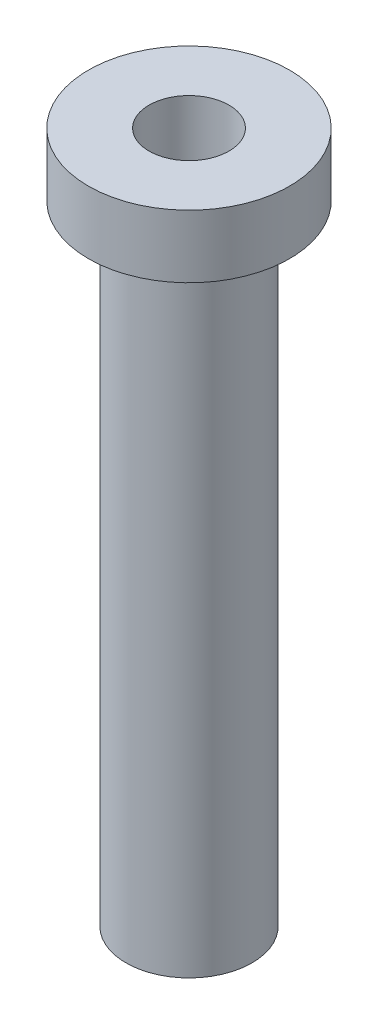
SolidWorks part; units mm, degrees
ref_plane "Front Plane" through (0, 0, 0) normal (0, 0, 1) x (1, 0, 0)
ref_plane "Top Plane" through (0, 0, 0) normal (0, 1, 0) x (1, 0, 0)
ref_plane "Right Plane" through (0, 0, 0) normal (1, 0, 0) x (0, 0, -1)
sketch "Sketch1" plane through (0, 0, 0) normal (0, 0, 1) x (1, 0, 0)
  line L0 (-3.175, 0) -> (-8, 0)
  line L1 (-8, 0) -> (-8, -5)
  line L2 (-8, -5) -> (-5.0127, -5)
  line L3 (-5.0127, -5) -> (-5.0127, -55)
  line L4 (-5.0127, -55) -> (0, -55)
  line L5 (0, -55) -> (0, -50)
  line L6 (-3.175, 0) -> (-3.175, -50)
  line L7 (-3.175, -50) -> (0, -50)
  line L8 (0, 0) -> (0, -55) construction
  line L9 (0, -50) -> (-3.175, -48.0923)
  dimension "D1" = 8
  dimension "D2" = 5.0127
  dimension "D3" = 55
  dimension "D4" = 5
  dimension "D5" = 6.35
  dimension "D6" = 50
  dimension "D7" = 31
revolve "Revolve1" add sketch "Sketch1" angle 360 about L5
